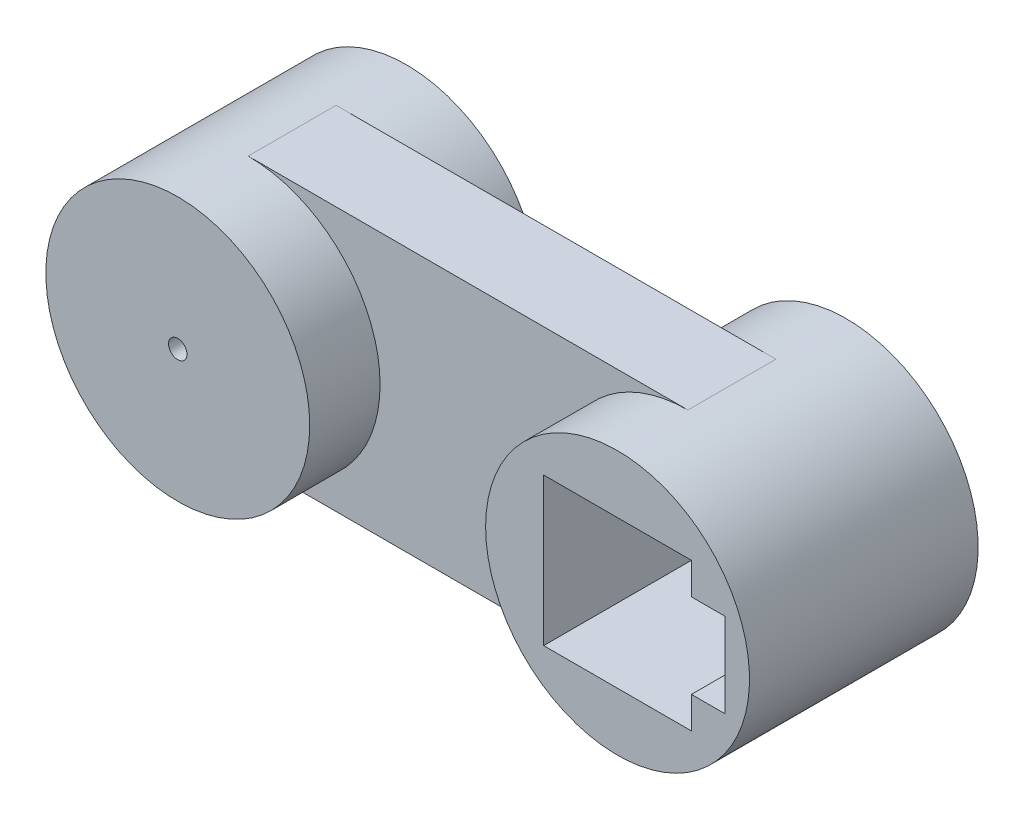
SolidWorks part; units mm, degrees
ref_plane "Front Plane" through (0, 0, 0) normal (0, 0, 1) x (1, 0, 0)
ref_plane "Top Plane" through (0, 0, 0) normal (0, 1, 0) x (1, 0, 0)
ref_plane "Right Plane" through (0, 0, 0) normal (1, 0, 0) x (0, 0, -1)
sketch "Sketch1" plane through (0, 0, 0) normal (0, 0, 1) x (1, 0, 0)
  circle A0 centre (0, 0) radius 38.1
  dimension "D1" = 76.2
extrude "Boss-Extrude1" add sketch "Sketch1" along normal mid plane 66.04
sketch "Sketch2" plane through (0, 0, 33.02) normal (0, 0, 1) x (1, 0, 0)
  line L0 (-2.5771, 1.905) -> (3.2415, 1.905)
  circle A0 centre (0, 0) radius 2.667
  point P5 (0, -2.667)
  dimension "D1" = 5.334
  dimension "D2" = 4.572
extrude "Cut-Extrude1" cut sketch "Sketch2" against normal blind 25.4 contours L0 A0
sketch "Sketch3" plane through (0, 0, 33.02) normal (0, 0, 1) x (1, 0, 0)
  circle A0 centre (0, 0) radius 2.667
extrude "Cut-Extrude2" cut sketch "Sketch3" against normal blind 5.588
sketch "Sketch4" plane through (0, 0, 0) normal (0, 0, 1) x (1, 0, 0)
  line L0 (0, 38.1) -> (127, 38.1)
  line L1 (0, -38.1) -> (127, -38.1)
  circle A0 centre (0, 0) radius 38.1 construction
  circle A1 centre (127, 0) radius 38.1
  circle A2 centre (0, 0) radius 38.1
  point P6 (0, 0)
  dimension "D1" = 127
extrude "Boss-Extrude2" add sketch "Sketch4" along normal mid plane 25.4 contours A2 L1 A1 L0
ref_plane "Plane1" through (63.5, 0, 0) normal (1, 0, 0) x (0, 0, -1)
mirror "Mirror2" about plane through (63.5, 0, 0) normal (1, 0, 0) of "Boss-Extrude1"
sketch "Sketch5" plane through (0, 0, 33.02) normal (0, 0, 1) x (1, 0, 0)
  line L0 (127, 38.1) -> (127, -38.1) construction
  line L1 (88.9, 0) -> (165.1, 0) construction
  line L3 (105.664, -21.336) -> (148.336, -21.336)
  line L4 (105.664, -21.336) -> (105.664, 21.336)
  line L5 (105.664, 21.336) -> (148.336, 21.336)
  line L6 (148.336, -21.336) -> (148.336, 21.336)
  line L7 (105.664, -21.336) -> (148.336, 21.336) construction
  line L8 (105.664, 21.336) -> (148.336, -21.336) construction
  line L9 (157.988, -12.192) -> (148.336, -12.192)
  line L10 (157.988, -12.192) -> (157.988, 12.192)
  line L11 (157.988, 12.192) -> (148.336, 12.192)
  line L12 (148.336, -12.192) -> (148.336, 12.192)
  line L13 (157.988, -12.192) -> (148.336, 12.192) construction
  line L14 (157.988, 12.192) -> (148.336, -12.192) construction
  circle A0 centre (127, 0) radius 38.1 construction
  arc A1 (127, 38.1) -> (127, -38.1) centre (127, 0) ccw construction
  point P11 (127, 0)
  point P16 (153.162, 0)
  dimension "D1" = 42.672
  dimension "D2" = 9.652
  dimension "D3" = 24.384
extrude "Cut-Extrude3" cut sketch "Sketch5" against normal blind 59.944 contours L3 L6 L5 L4 | L10 L11 L6 L9
